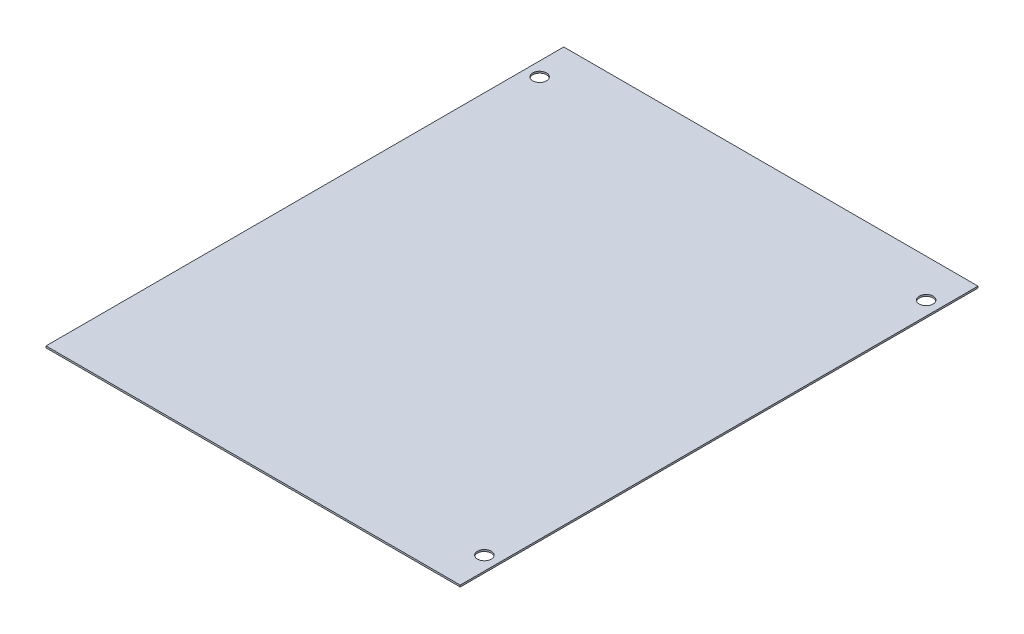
SolidWorks part; units mm, degrees
ref_plane "Front Plane" through (0, 0, 0) normal (0, 0, 1) x (1, 0, 0)
ref_plane "Top Plane" through (0, 0, 0) normal (0, 1, 0) x (1, 0, 0)
ref_plane "Right Plane" through (0, 0, 0) normal (1, 0, 0) x (0, 0, -1)
sketch "Sketch1" plane through (0, 0, 0) normal (0, 1, 0) x (1, 0, 0)
  line L1 (-74.1687, 1849.3039) -> (1449.8313, 1849.3039)
  line L2 (-74.1687, 1849.3039) -> (-74.1687, -55.6961)
  line L3 (-74.1687, -55.6961) -> (1449.8313, -55.6961)
  line L4 (1449.8313, 1849.3039) -> (1449.8313, -55.6961)
  dimension "D1" = 1905
  dimension "D2" = 1524
extrude "Boss-Extrude1" add sketch "Sketch1" along normal blind 6.35
sketch "Sketch3" plane through (0, 6.35, 0) normal (0, 1, 0) x (-1, 0, 0)
  line L0 (-1449.8313, -1849.3039) -> (74.1687, -1849.3039) construction
  line L1 (23.3687, -1709.6039) -> (-1399.0313, -1709.6039) construction
  line L2 (23.3687, -1709.6039) -> (23.3687, -84.0039) construction
  line L3 (23.3687, -84.0039) -> (-1399.0313, -84.0039) construction
  line L4 (-1399.0313, -1709.6039) -> (-1399.0313, -84.0039) construction
  line L5 (74.1687, 55.6961) -> (-1449.8313, 55.6961) construction
  line L6 (-1449.8313, 55.6961) -> (-1449.8313, -1849.3039) construction
  line L7 (74.1687, -1849.3039) -> (74.1687, 55.6961) construction
  circle A0 centre (23.3687, -1709.6039) radius 25.4
  circle A1 centre (-1399.0313, -84.0039) radius 25.4
  circle A3 centre (-1399.0313, -1709.6039) radius 25.4
  dimension "D1" = 50.8
  dimension "D3" = 50.8
  dimension "D5" = 139.7
  dimension "D6" = 139.7
  dimension "D7" = 50.8
  dimension "D8" = 50.8
extrude "Cut-Extrude1" cut sketch "Sketch3" against normal blind 25.4
